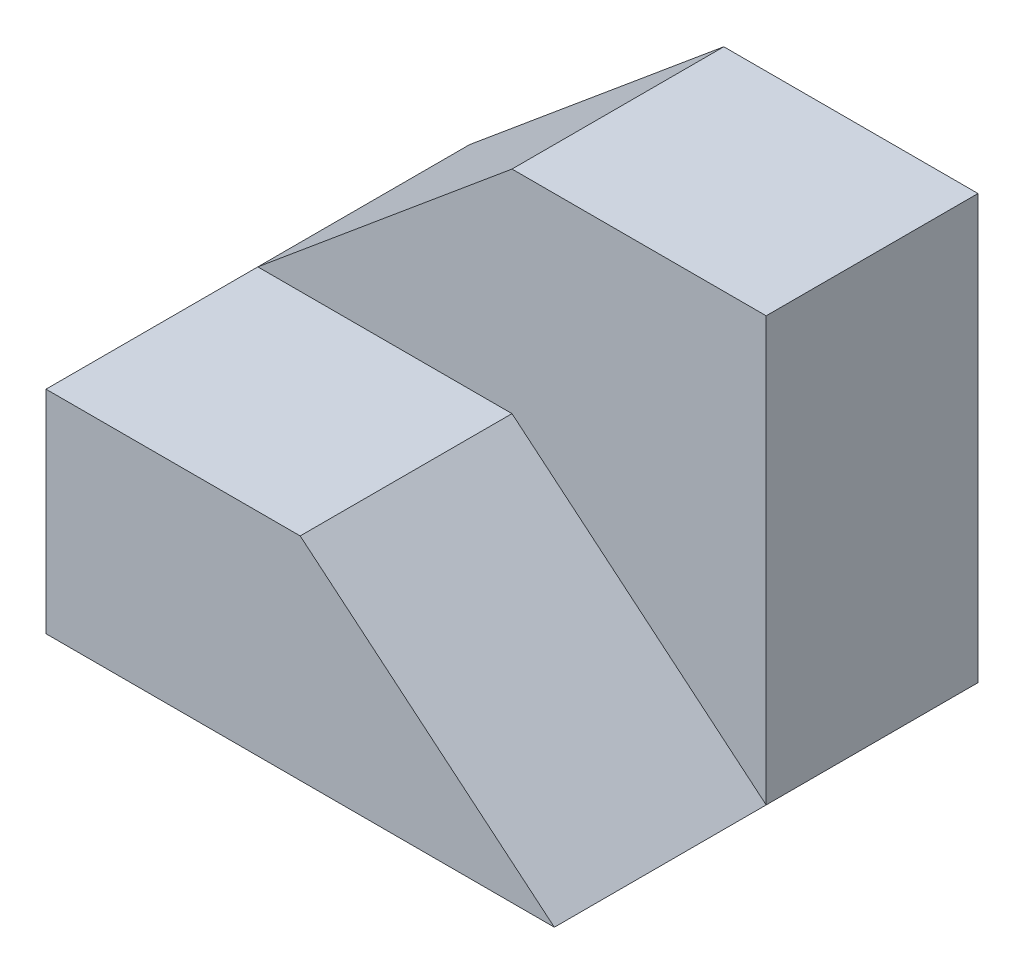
SolidWorks part; units mm, degrees
ref_plane "前视基准面" through (0, 0, 0) normal (0, 0, 1) x (1, 0, 0)
ref_plane "上视基准面" through (0, 0, 0) normal (0, 1, 0) x (1, 0, 0)
ref_plane "右视基准面" through (0, 0, 0) normal (1, 0, 0) x (0, 0, -1)
sketch "草图1" plane through (0, 0, 0) normal (0, 0, 1) x (1, 0, 0)
  line L0 (-60, 0) -> (60, 0)
  line L1 (-60, 0) -> (-60, 50)
  line L2 (-60, 50) -> (0, 50)
  line L3 (0, 50) -> (60, 0)
extrude "拉伸1" add sketch "草图1" against normal blind 100
sketch "草图2" plane through (0, 0, -100) normal (0, 0, -1) x (-1, 0, 0)
  line L0 (-60, 0) -> (-60, 100)
  line L1 (-60, 100) -> (0, 100)
  line L3 (60, 50) -> (0, 50)
  line L4 (0, 50) -> (-60, 0)
  line L5 (60, 50) -> (0, 100)
extrude "拉伸2" add sketch "草图2" against normal blind 50
